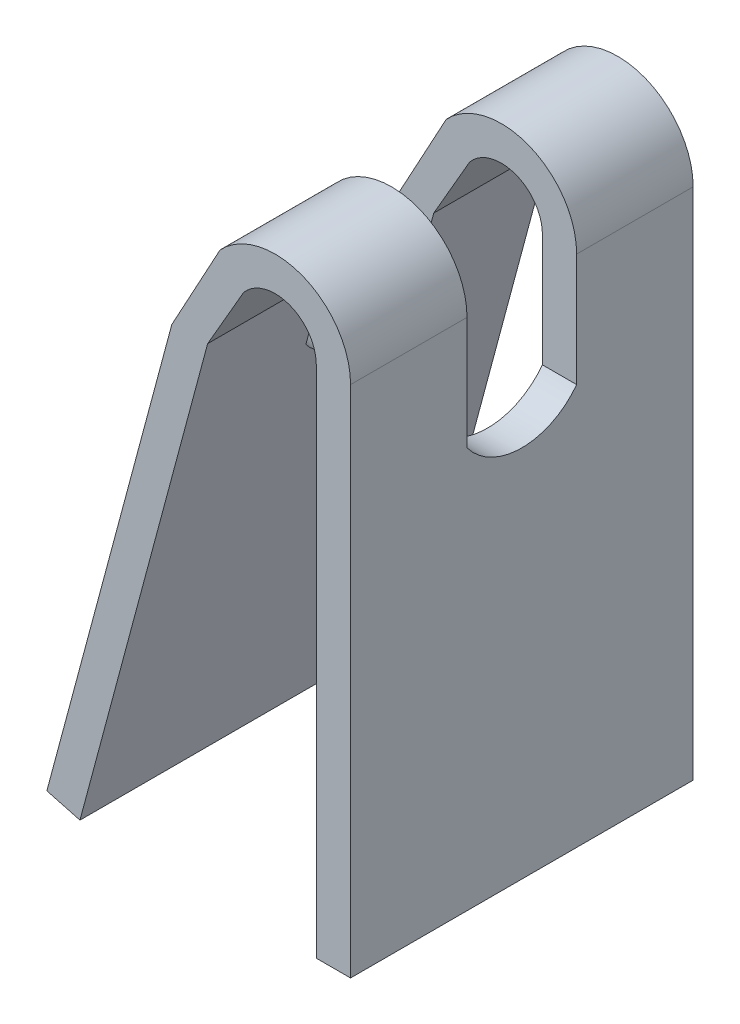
SolidWorks part; units mm, degrees
ref_plane "Front" through (0, 0, 0) normal (0, 0, 1) x (1, 0, 0)
ref_plane "Top" through (0, 0, 0) normal (0, 1, 0) x (1, 0, 0)
ref_plane "Right" through (0, 0, 0) normal (1, 0, 0) x (0, 0, -1)
sketch "Esquisse1" plane through (0, 0, 0) normal (0, 0, 1) x (1, 0, 0)
  line L0 (0, 0) -> (5, 0)
  line L1 (5, 0) -> (5, 75)
  line L2 (0, 0) -> (0, 75)
  line L3 (-10.6078, 78.843) -> (-15.8578, 69.7497)
  line L4 (-15.8578, 69.7497) -> (-34.4927, 0.2031)
  line L5 (-34.4927, 0.2031) -> (-39.3224, 1.4972)
  line L6 (-14.0427, 82.5044) -> (-21.0854, 69.5583)
  line L7 (-39.3224, 1.4972) -> (-21.0854, 69.5583)
  arc A0 (0, 75) -> (-10.6078, 78.843) centre (-6, 75) ccw
  arc A1 (5, 75) -> (-14.0427, 82.5044) centre (-6, 75) ccw
  dimension "D4" = 6
  dimension "D10" = 11
  dimension "D1" = 5
  dimension "D2" = 75
  dimension "D3" = 75
  dimension "D5" = 30
  dimension "D6" = 10.5
  dimension "D7" = 15
  dimension "D8" = 5
  dimension "D9" = 72
  dimension "D11" = 15
extrude "Base-Extrusion" add sketch "Esquisse1" along normal blind 50
sketch "Esquisse2" plane through (5, 0, 0) normal (1, 0, 0) x (0, 0, -1)
  line L0 (0, 0) -> (0, 75) construction
  line L1 (-33, 90.023) -> (-17, 90.023)
  line L2 (-33, 90.023) -> (-33, 58.5)
  line L3 (-50, 0) -> (0, 0) construction
  line L4 (-17, 90.023) -> (-17, 58.5)
  line L5 (-50, 0) -> (-50, 75) construction
  arc A0 (-33, 58.5) -> (-17, 58.5) centre (-25, 64.5) ccw
  dimension "D3" = 54.5
  dimension "D4" = 10
  dimension "D1" = 17
  dimension "D2" = 17
extrude "Enlèv. mat.-Extru.1" cut sketch "Esquisse2" against normal blind 10
sketch "Esquisse3" plane through (-37.0625, 9.9309, 0) normal (-0.9659, 0.2588, 0) x (0, 0, 1)
  line L1 (17, 86.233) -> (33, 86.233)
  line L2 (17, 86.233) -> (17, 53)
  line L3 (50, 0) -> (0, 0) construction
  line L4 (33, 86.233) -> (33, 53)
  line L5 (50, 61.7308) -> (50, -8.7312) construction
  arc A0 (17, 53) -> (33, 53) centre (25, 59) ccw
  dimension "D3" = 49
  dimension "D4" = 10
  dimension "D1" = 17
  dimension "D2" = 16
  dimension "D5" = 8
extrude "Enlèv. mat.-Extru.2" cut sketch "Esquisse3" against normal blind 15
